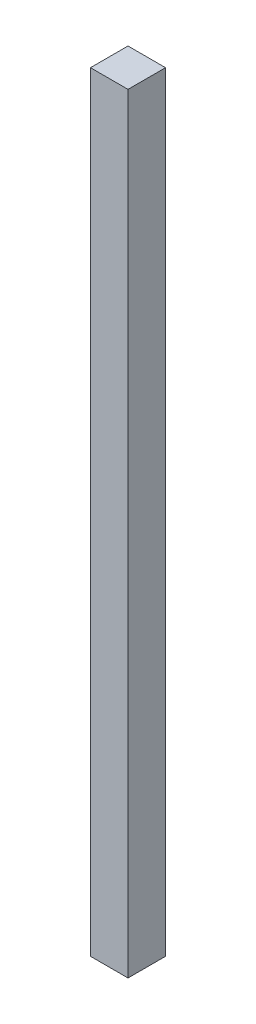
SolidWorks part; units mm, degrees
ref_plane "Plan de face" through (0, 0, 0) normal (0, 0, 1) x (1, 0, 0)
ref_plane "Plan de dessus" through (0, 0, 0) normal (0, 1, 0) x (1, 0, 0)
ref_plane "Plan de droite" through (0, 0, 0) normal (1, 0, 0) x (0, 0, -1)
sketch "Esquisse1" plane through (0, 0, 0) normal (0, 0, 1) x (1, 0, 0)
  line L1 (-40, 0) -> (0, 0)
  line L2 (-40, 0) -> (-40, 820)
  line L3 (-40, 820) -> (0, 820)
  line L4 (0, 0) -> (0, 820)
extrude "Boss.-Extru.1" add sketch "Esquisse1" against normal blind 40
